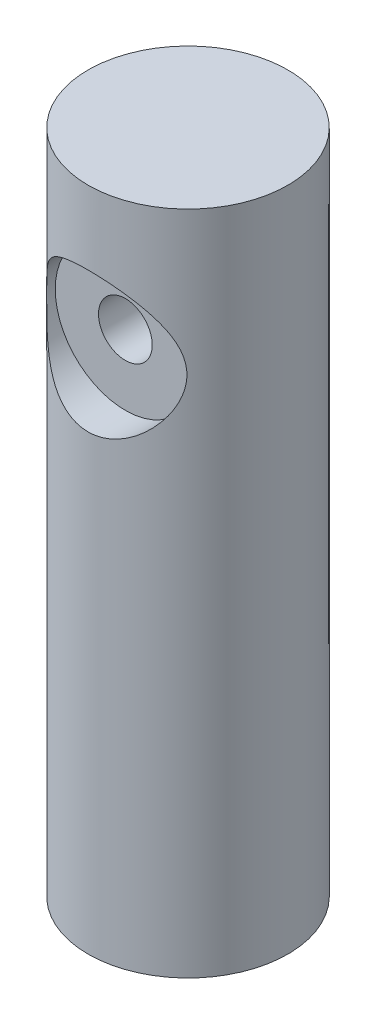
SolidWorks part; units mm, degrees
ref_plane "Front Plane" through (0, 0, 0) normal (0, 0, 1) x (1, 0, 0)
ref_plane "Top Plane" through (0, 0, 0) normal (0, 1, 0) x (1, 0, 0)
ref_plane "Right Plane" through (0, 0, 0) normal (1, 0, 0) x (0, 0, -1)
sketch "Sketch3" plane through (0, 0, 0) normal (0, 1, 0) x (1, 0, 0)
  circle A0 centre (0, 0) radius 15
  dimension "D1" = 30
extrude "Extrude2" add sketch "Sketch3" along normal blind 100
sketch "Sketch4" plane through (0, 0, 0) normal (1, 0, 0) x (0, 0, -1)
  line L0 (-15, 88.9714) -> (-9.4069, 88.9714)
  line L1 (-15, 100) -> (-15, 0) construction
  line L2 (-9.4069, 88.9714) -> (-9.4069, 82.4761)
  line L3 (-9.4069, 82.4761) -> (9.1829, 82.4761)
  line L4 (9.1829, 82.4761) -> (9.1829, 88.9714)
  line L5 (9.1829, 88.9714) -> (15, 88.9714)
  line L6 (15, 0) -> (15, 100) construction
  line L7 (15, 88.9714) -> (15, 78.4446)
  line L8 (15, 78.4446) -> (-15, 78.4446)
  line L9 (-15, 78.4446) -> (-15, 88.9714)
revolve "Cut-Revolve3" cut sketch "Sketch4" angle 360 about L8
